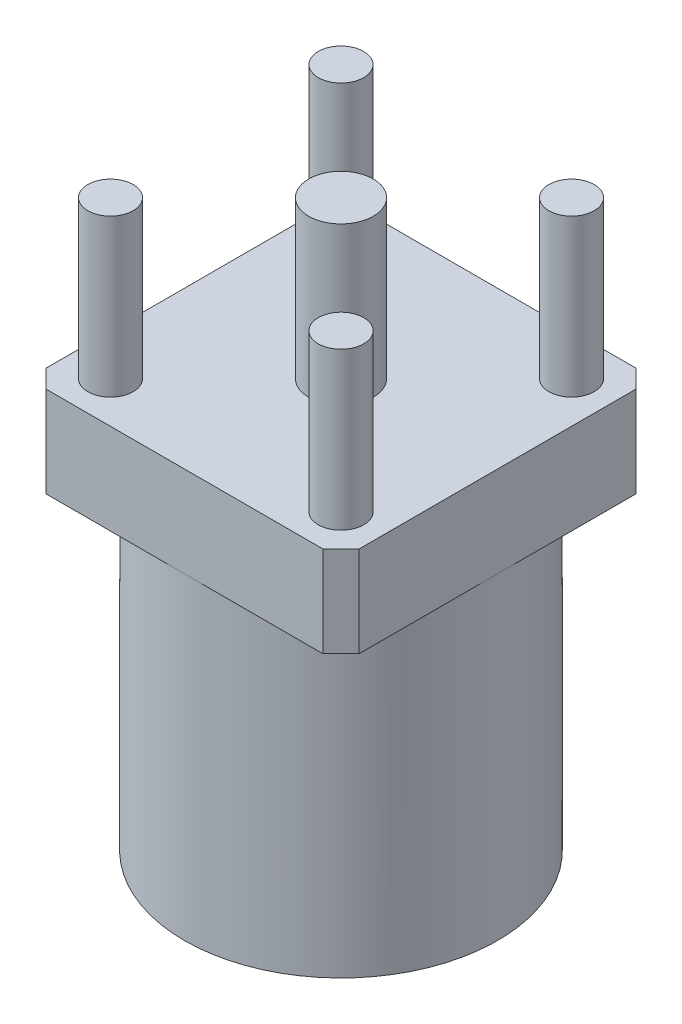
SolidWorks part; units mm, degrees
ref_plane "Front Plane" through (0, 0, 0) normal (0, 0, 1) x (1, 0, 0)
ref_plane "Top Plane" through (0, 0, 0) normal (0, 1, 0) x (1, 0, 0)
ref_plane "Right Plane" through (0, 0, 0) normal (1, 0, 0) x (0, 0, -1)
sketch "Sketch3" plane through (0, 0, 0) normal (0, 1, 0) x (1, 0, 0)
  line L0 (-1.725, -1.525) -> (-1.525, -1.725)
  line L1 (-1.525, -1.725) -> (1.525, -1.725)
  line L2 (-1.725, -1.525) -> (-1.725, 1.525)
  line L3 (-1.525, 1.725) -> (1.525, 1.725)
  line L4 (1.725, -1.525) -> (1.725, 1.525)
  line L5 (1.525, -1.725) -> (1.725, -1.525)
  line L6 (1.525, 1.725) -> (1.725, 1.525)
  line L7 (-1.725, 1.525) -> (-1.525, 1.725)
  line L9 (-1.27, -1.27) -> (1.27, -1.27) construction
  line L10 (-1.27, -1.27) -> (-1.27, 1.27) construction
  line L11 (-1.27, 1.27) -> (1.27, 1.27) construction
  line L12 (1.27, -1.27) -> (1.27, 1.27) construction
  circle A0 centre (0, 0) radius 1.725 construction
  circle A1 centre (0, 0) radius 1.375 construction
  circle A2 centre (0, 0) radius 0.35 construction
  circle A3 centre (-1.27, -1.27) radius 0.25 construction
  circle A4 centre (1.27, -1.27) radius 0.25 construction
  circle A5 centre (1.27, 1.27) radius 0.25 construction
  circle A6 centre (-1.27, 1.27) radius 0.25 construction
  point P0 (-1.725, -1.725)
  point P1 (1.725, 1.725)
  point P2 (-1.725, 1.725)
  point P3 (1.725, -1.725)
  point P23 (0, -1.27)
  point P24 (-1.27, 0)
  dimension "D3" = 0.7
  dimension "D4" = 0.5
  dimension "D1" = 3.45
  dimension "D5" = 2.54
  dimension "D2" = 0.35
extrude "Boss-Extrude1" add sketch "Sketch3" along normal blind 1
sketch "Sketch4" plane through (0, 0, 0) normal (0, -1, 0) x (1, 0, 0)
  line L8 (1.525, 1.725) -> (-1.525, 1.725)
  line L9 (-1.525, 1.725) -> (-1.725, 1.525)
  line L10 (-1.725, 1.525) -> (-1.725, -1.525)
  line L11 (-1.725, -1.525) -> (-1.525, -1.725)
  line L12 (-1.525, -1.725) -> (1.525, -1.725)
  line L13 (1.525, -1.725) -> (1.725, -1.525)
  line L14 (1.725, -1.525) -> (1.725, 1.525)
  line L15 (1.725, 1.525) -> (1.525, 1.725)
  line L16 (1.525, 1.725) -> (-1.525, 1.725)
  line L17 (-1.525, 1.725) -> (-1.725, 1.525)
  line L18 (-1.725, 1.525) -> (-1.725, -1.525)
  line L19 (-1.725, -1.525) -> (-1.525, -1.725)
  line L20 (-1.525, -1.725) -> (1.525, -1.725)
  line L21 (1.525, -1.725) -> (1.725, -1.525)
  line L22 (1.725, -1.525) -> (1.725, 1.525)
  line L23 (1.725, 1.525) -> (1.525, 1.725)
  circle A0 centre (0, 0) radius 1.725 construction
  circle A1 centre (0, 0) radius 1.375 construction
  circle A2 centre (0, 0) radius 0.35 construction
  circle A3 centre (0, 0) radius 1.725
  circle A4 centre (0, 0) radius 1.375
  circle A5 centre (0, 0) radius 0.35
  dimension "D1" = 0
extrude "Boss-Extrude2" add sketch "Sketch4" along normal blind 3.5 contours A3 A4 | A5
sketch "Sketch5" plane through (0, 1, 0) normal (0, 1, 0) x (1, 0, 0)
  circle A0 centre (-1.27, 1.27) radius 0.25 construction
  circle A1 centre (-1.27, -1.27) radius 0.25 construction
  circle A2 centre (1.27, 1.27) radius 0.25 construction
  circle A3 centre (1.27, -1.27) radius 0.25 construction
  circle A4 centre (-1.27, 1.27) radius 0.25
  circle A5 centre (-1.27, -1.27) radius 0.25
  circle A6 centre (1.27, 1.27) radius 0.25
  circle A7 centre (1.27, -1.27) radius 0.25
  circle A8 centre (0, 0) radius 0.3556
  dimension "D1" = 0.5
  dimension "D2" = 0.7112
extrude "Boss-Extrude3" add sketch "Sketch5" along normal blind 1.7272
sketch "Sketch6" plane through (0, -3.5, 0) normal (0, -1, 0) x (1, 0, 0)
  circle A1 centre (0, 0) radius 0.35
  circle A2 centre (0, 0) radius 0.35
  dimension "D1" = 0
extrude "Cut-Extrude1" cut sketch "Sketch6" against normal blind 1.016
